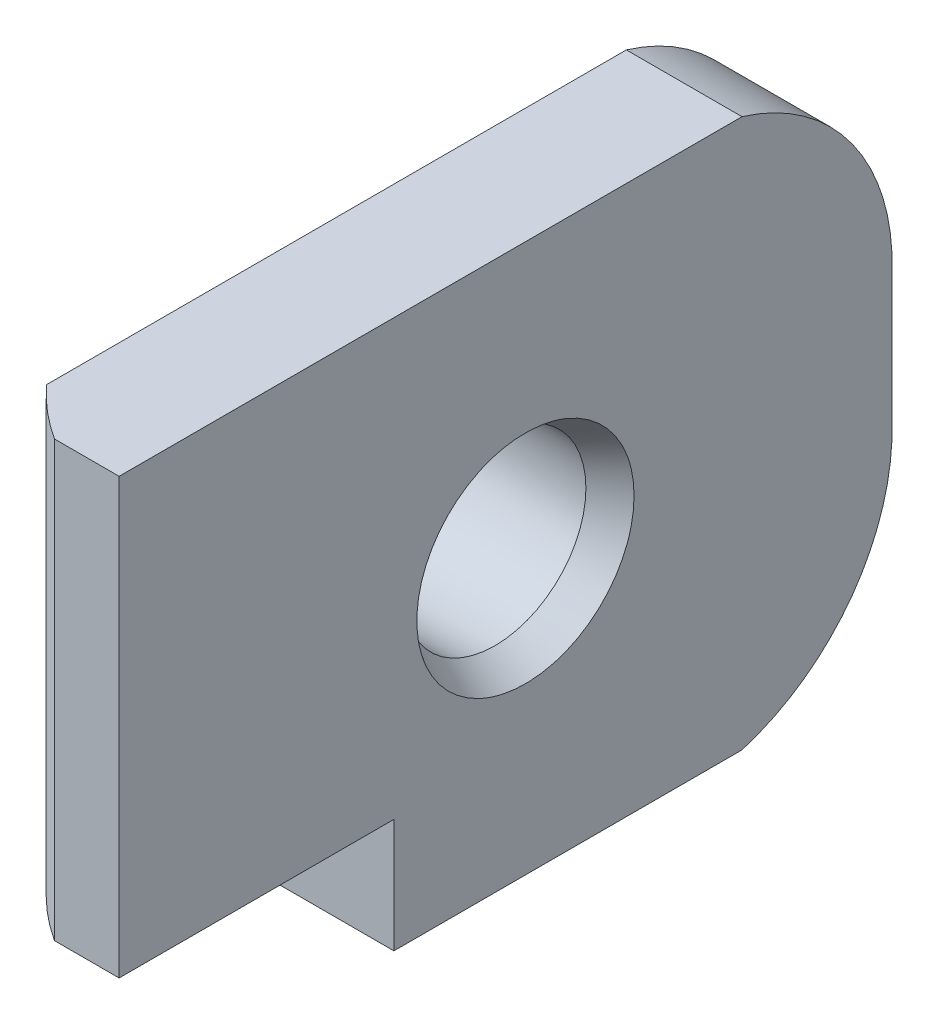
SolidWorks part; units mm, degrees
ref_plane "Front Plane" through (0, 0, 0) normal (0, 0, 1) x (1, 0, 0)
ref_plane "Top Plane" through (0, 0, 0) normal (0, 1, 0) x (1, 0, 0)
ref_plane "Right Plane" through (0, 0, 0) normal (1, 0, 0) x (0, 0, -1)
sketch "Sketch1" plane through (0, 0, 0) normal (0, 0, 1) x (1, 0, 0)
  line L0 (0, 0) -> (0, 11.8618)
  line L1 (0, 11.8618) -> (-2.5019, 11.8618)
  line L2 (-2.5019, 11.8618) -> (-2.5019, 10.16)
  line L3 (-2.7559, 9.906) -> (-3.2004, 9.906)
  line L4 (-3.4544, 9.652) -> (-3.4544, 2.2098)
  line L5 (-3.2004, 1.9558) -> (-2.7559, 1.9558)
  line L6 (-2.5019, 1.7018) -> (-2.5019, 0)
  line L7 (-2.5019, 0) -> (0, 0)
  arc A0 (-2.5019, 10.16) -> (-2.7559, 9.906) centre (-2.7559, 10.16) cw
  arc A1 (-3.4544, 9.652) -> (-3.2004, 9.906) centre (-3.2004, 9.652) cw
  arc A2 (-3.4544, 2.2098) -> (-3.2004, 1.9558) centre (-3.2004, 2.2098) ccw
  arc A3 (-2.5019, 1.7018) -> (-2.7559, 1.9558) centre (-2.7559, 1.7018) ccw
  point P13 (-3.4544, 9.906)
  point P16 (-3.4544, 1.9558)
  dimension "D5" = 0.254
  dimension "D1" = 7.9502
  dimension "D2" = 2.5019
  dimension "D3" = 3.4544
  dimension "D4" = 11.8618
extrude "Boss-Extrude1" add sketch "Sketch1" along normal blind 16.7132 contours L0 L1 L2 A0 L3 A1 L4 A2 L5 A3 L6 L7
sketch "Sketch2" plane through (-2.5019, 0, 0) normal (-1, 0, 0) x (0, 0, 1)
  line L0 (10.7696, 0) -> (10.7696, 2.4638)
  line L1 (16.7132, 0) -> (0, 0) construction
  line L2 (10.7696, 2.4638) -> (16.7132, 2.4638)
  line L3 (16.7132, 9.652) -> (16.7132, 2.2098) construction
  line L4 (16.7132, 2.4638) -> (16.7132, 0)
  line L5 (16.7132, 0) -> (10.7696, 0)
  line L6 (0, 1.7018) -> (0, 0) construction
  line L7 (16.7132, 11.8618) -> (0, 11.8618) construction
  line L8 (0, 9.652) -> (0, 2.2098) construction
  line L9 (7.9248, 5.9309) -> (-49992.0752, 5.9309) construction
  line L10 (0, 7.7196) -> (0, 4.1422) construction
  line L11 (0, 4.1422) -> (0, 7.7196)
  circle A0 centre (7.9248, 5.9309) radius 1.9685
  arc A1 (0, 7.7196) -> (3.2404, 11.8618) centre (4.566, 7.4862) cw
  arc A2 (3.2404, 0) -> (0, 4.1422) centre (4.566, 4.3756) cw
  spline S0 degree 3 poles (3.2404, 11.8618) (13.1909, 15.5519) (-11.8059, 18.1587) (-6.7228, -7.2398) (19.2342, -4.0006) (3.2404, 0) knots 0 0 0 0 0.324873 0.575 1 1 1 1
  point P17 (16.7132, 5.9309)
  point P26 (0, 5.9309)
  dimension "D3" = 3.937
  dimension "D5" = 4.572
  dimension "D1" = 10.7696
  dimension "D2" = 9.398
  dimension "D4" = 7.9248
extrude "Cut-Extrude1" cut sketch "Sketch2" against normal through all both and the other way through all contours S0 A2 L11 A1 | A0 | L4 L5 L0 L2
sketch "Sketch3" plane through (0, 2.4638, 0) normal (0, -1, 0) x (-1, 0, 0)
  line L0 (3.4544, -10.7696) -> (3.4544, -16.7132) construction
  line L3 (0, -16.7132) -> (3.4544, -16.7132) construction
  line L4 (3.4544, -14.3421) -> (3.4544, -16.7132)
  line L5 (3.4544, -16.7132) -> (1.3985, -16.7132)
  arc A0 (3.4544, -14.3421) -> (1.3985, -16.7132) centre (-1.6256, -12.0142) cw
  dimension "D1" = 5.588
  dimension "D2" = 5.08
  dimension "D3" = 4.699
extrude "Cut-Extrude2" cut sketch "Sketch3" against normal through all both and the other way through all
ref_plane "Plane1" through (0, 5.9309, 0) normal (0, 1, 0) x (1, 0, 0)
sketch "Sketch4" plane through (0, 5.9309, 0) normal (0, 1, 0) x (1, 0, 0)
  line L0 (0, -5.575) -> (-0.6604, -5.9563)
  line L1 (0, -10.2746) -> (-0.6604, -9.8933)
  line L2 (0, -10.7696) -> (0, -3.2404) construction
  line L3 (0, -9.8933) -> (0, -5.9563) construction
  dimension "D1" = 60
  dimension "D2" = 0.6604
ref_plane "Plane2" through (-0.6604, 0, 0) normal (1, 0, 0) x (0, 0, -1)
sketch "Sketch5" plane through (-0.6604, 0, 0) normal (1, 0, 0) x (0, 0, -1)
  circle A0 centre (-7.9248, 5.9309) radius 1.9685
  circle A1 centre (-7.9248, 5.9309) radius 1.9685 construction
sketch "Sketch6" plane through (0, 0, 0) normal (1, 0, 0) x (0, 0, -1)
  circle A0 centre (-7.9248, 5.9309) radius 2.3498
loft "Cut-Loft1" cut profiles "Sketch5", "Sketch6"
